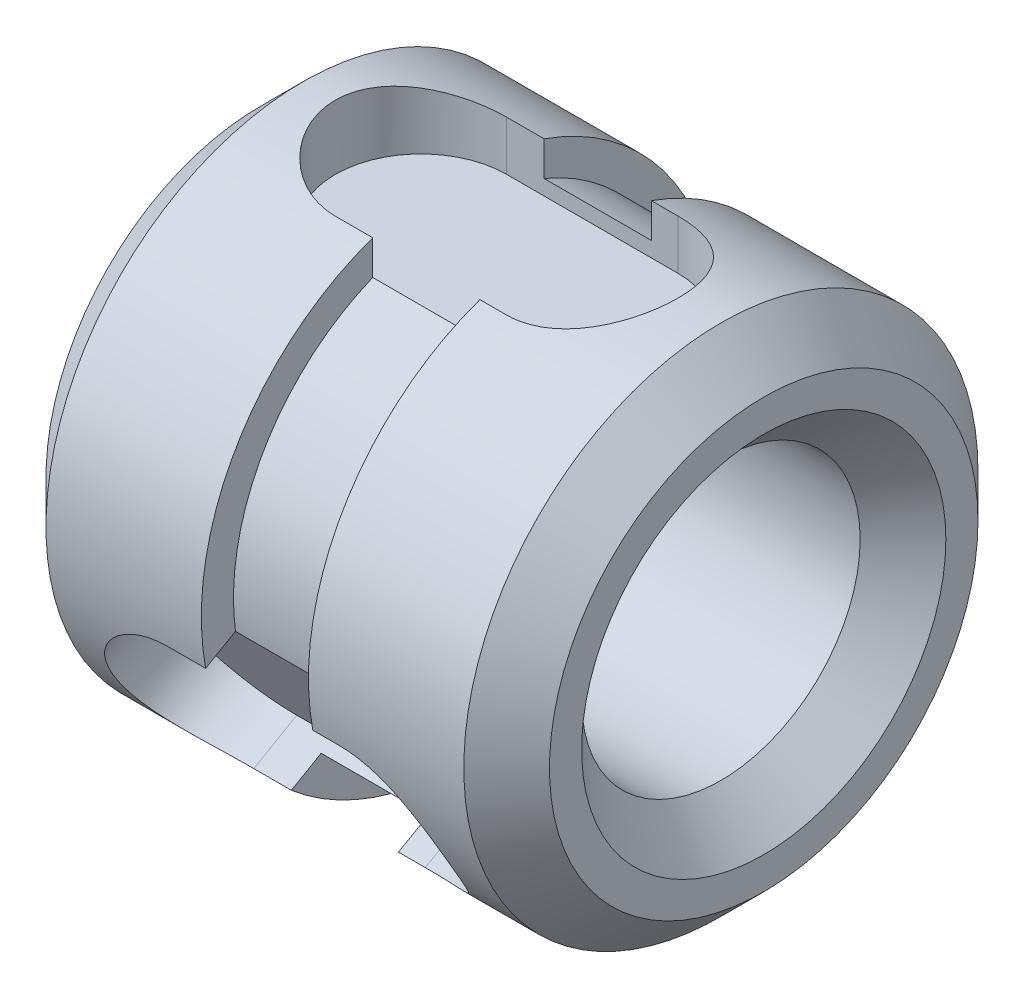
SolidWorks part; units mm, degrees
ref_plane "Front Plane" through (0, 0, 0) normal (0, 0, 1) x (1, 0, 0)
ref_plane "Top Plane" through (0, 0, 0) normal (0, 1, 0) x (1, 0, 0)
ref_plane "Right Plane" through (0, 0, 0) normal (1, 0, 0) x (0, 0, -1)
sketch "Sketch1" plane through (0, 0, 0) normal (0, 0, 1) x (1, 0, 0)
  line L0 (0, 0) -> (-29.1683, 0) construction
  line L1 (-21.5, 12) -> (-2, 12)
  line L2 (-23.5, 10) -> (-23.5, 8.5)
  line L3 (-21.5, 6.5) -> (-2, 6.5)
  line L4 (0, 10) -> (0, 8.5)
  line L5 (-2, 12) -> (0, 10)
  line L6 (-2, 6.5) -> (0, 8.5)
  line L7 (-23.5, 10) -> (-21.5, 12)
  line L8 (-23.5, 8.5) -> (-21.5, 6.5)
  point P0 (-23.5, 12)
  point P1 (0, 6.5)
  point P2 (-23.5, 6.5)
  point P3 (0, 12)
  dimension "D1" = 24
  dimension "D2" = 13
  dimension "D3" = 23.5
revolve "Revolve1" add sketch "Sketch1" angle 360 about L0
sketch "Sketch2" plane through (0, 0, 0) normal (0, 1, 0) x (1, 0, 0)
  line L0 (-16, 0) -> (-8, 0) construction
  line L1 (-16, 4) -> (-8, 4)
  line L2 (-16, -4) -> (-8, -4)
  line L6 (0, -10) -> (0, 10) construction
  arc A0 (-16, 4) -> (-16, -4) centre (-16, 0) ccw
  arc A1 (-8, -4) -> (-8, 4) centre (-8, 0) ccw
  point P2 (-12, 0)
  dimension "D1" = 4
  dimension "D3" = 8
  dimension "D2" = 8
extrude "Cut-Extrude1" cut sketch "Sketch2" along normal through all from offset 9
pattern_circular "CirPattern1" count 3 over 360 about axis through (0, 0, 0) along (1, 0, 0) of "Cut-Extrude1"
sketch3d "CAMWorksSketchPoint"
  point P0 (-260.1, -143.3887, -337)
  point P1 (677, 265, 300)
sketch "Sketch3" plane through (0, 0, 0) normal (0, 0, 1) x (1, 0, 0)
  line L0 (0, 0) -> (-23.5, 0) construction
  line L1 (-23.5, 10) -> (-23.5, -10) construction
  line L2 (-14.25, 18.5) -> (-9.25, 18.5)
  line L3 (-14.25, 18.5) -> (-14.25, 10.5)
  line L4 (-14.25, 10.5) -> (-9.25, 10.5)
  line L5 (-9.25, 18.5) -> (-9.25, 10.5)
  line L6 (-21.5, -12) -> (-2, -12) construction
  point P7 (-11.75, 10.5)
  point P12 (-11.75, -12)
  dimension "D2" = 5
  dimension "D3" = 21
  dimension "D4" = 8
revolve "Cut-Revolve1" cut sketch "Sketch3" angle 360 about L0
